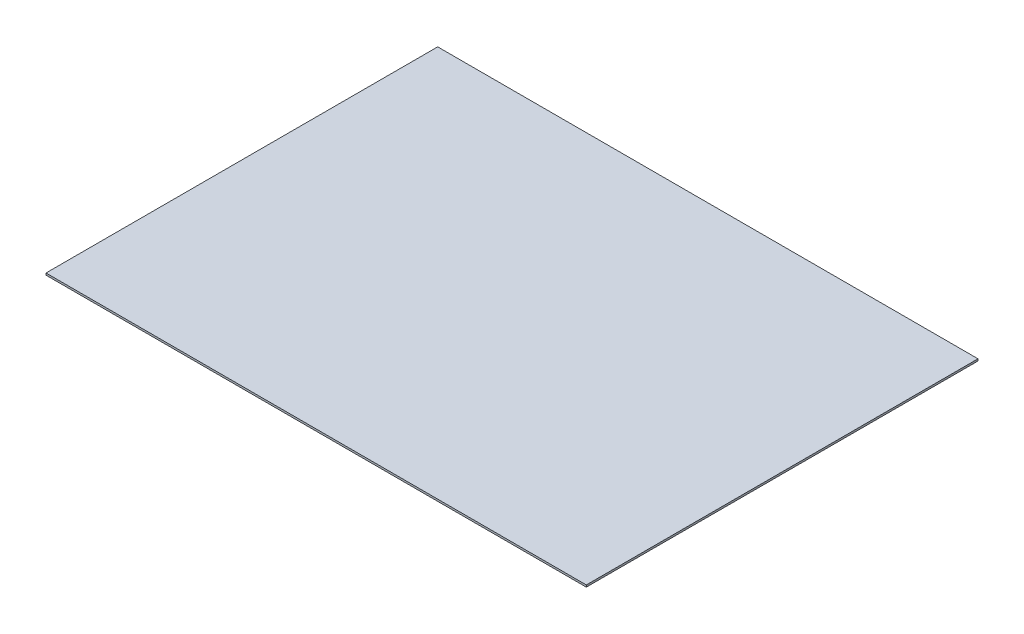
SolidWorks part; units mm, degrees
ref_plane "Alzado" through (0, 0, 0) normal (0, 0, 1) x (1, 0, 0)
ref_plane "Planta" through (0, 0, 0) normal (0, 1, 0) x (1, 0, 0)
ref_plane "Vista lateral" through (0, 0, 0) normal (1, 0, 0) x (0, 0, -1)
sketch "Croquis1" plane through (0, 0, 0) normal (0, 0, 1) x (1, 0, 0)
  line L0 (349, 1.25) -> (-349, -1.25) construction
  line L1 (-349, 1.25) -> (349, 1.25)
  line L2 (-349, 1.25) -> (-349, -1.25)
  line L3 (-349, -1.25) -> (349, -1.25)
  line L4 (349, 1.25) -> (349, -1.25)
extrude "Extruir1" add sketch "Croquis1" along normal mid plane 506
